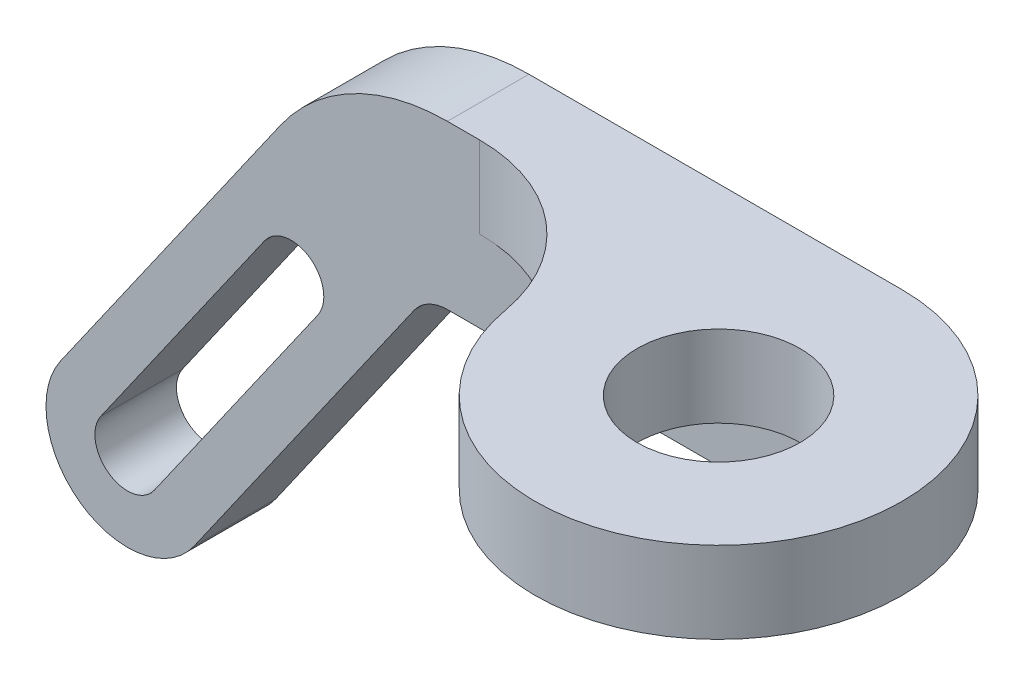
SolidWorks part; units mm, degrees
ref_plane "Front Plane" through (0, 0, 0) normal (0, 0, 1) x (1, 0, 0)
ref_plane "Top Plane" through (0, 0, 0) normal (0, 1, 0) x (1, 0, 0)
ref_plane "Right Plane" through (0, 0, 0) normal (1, 0, 0) x (0, 0, -1)
sketch "Sketch1" plane through (0, 0, 0) normal (0, 0, 1) x (1, 0, 0)
  line L0 (-47.4288, -24.1491) -> (-20.4788, 14.3394)
  line L1 (0, 25) -> (45.7628, 25)
  line L2 (-31.0457, -35.6207) -> (-4.0958, 2.8679)
  line L3 (0, 5) -> (45.7628, 5)
  line L4 (45.7628, 25) -> (45.7628, 5)
  arc A0 (-20.4788, 14.3394) -> (0, 25) centre (0, 0) cw
  arc A1 (-4.0958, 2.8679) -> (0, 5) centre (0, 0) cw
  arc A2 (-47.4288, -24.1491) -> (-31.0457, -35.6207) centre (-39.2372, -29.8849) ccw
  arc A3 (-20.4788, 14.3394) -> (0, 25) centre (0, 0) cw construction
  point P2 (-13.0142, 25)
  dimension "D3" = 25
  dimension "D1" = 125
  dimension "D4" = 60
  dimension "D5" = 85
  dimension "D2" = 20
extrude "Boss-Extrude1" add sketch "Sketch1" along normal blind 10
sketch "Sketch2" plane through (0, 25, 0) normal (0, 1, 0) x (1, 0, 0)
  line L0 (45.7628, 0) -> (0, 0) construction
  line L1 (45.7628, -10) -> (45.7628, 0) construction
  circle A0 centre (45.7628, -22.5) radius 22.5
  dimension "D1" = 45
extrude "Boss-Extrude2" add sketch "Sketch2" against normal blind 10
fillet "Fillet1" radius 20 1 edges at (27.0545, 20, 10)
sketch "Sketch3" plane through (0, 0, 10) normal (0, 0, 1) x (1, 0, 0)
  line L0 (-39.2372, -29.8849) -> (-19.1621, -1.2146) construction
  line L1 (-42.5139, -27.5906) -> (-22.4387, 1.0797)
  line L2 (-35.9606, -32.1792) -> (-15.8855, -3.5089)
  line L3 (-31.0457, -35.6207) -> (-4.0958, 2.8679) construction
  arc A0 (-42.5139, -27.5906) -> (-35.9606, -32.1792) centre (-39.2372, -29.8849) ccw
  arc A1 (-15.8855, -3.5089) -> (-22.4387, 1.0797) centre (-19.1621, -1.2146) ccw
  point P3 (-29.1997, -15.5497)
  dimension "D1" = 8
  dimension "D2" = 43
extrude "Cut-Extrude1" cut sketch "Sketch3" against normal through all
hole_wizard "Ø20.0 (20) Diameter Hole1" positions "Sketch5" profile "Sketch4" hole size "Ø20.0" standard "ANSI Metric"
sketch "Sketch5" plane through (0, 25, 0) normal (0, 1, 0) x (1, 0, 0)
  point P0 (45.7628, -22.5)
sketch "Sketch4" plane through (45.7628, 25, 22.5) normal (1, 0, 0) x (0, 0, 1)
  line L0 (0, 0) -> (0, 64.8849)
  line L1 (0, 64.8849) -> (10, 64.8849)
  line L2 (10, 64.8849) -> (10, 0)
  line L5 (10, 0) -> (0, 0)
  line L11 (0, -6.35) -> (0, 107.95) construction
  dimension "Thru Hole Dia." = 20
  dimension "Thru Hole Depth" = 64.8849
